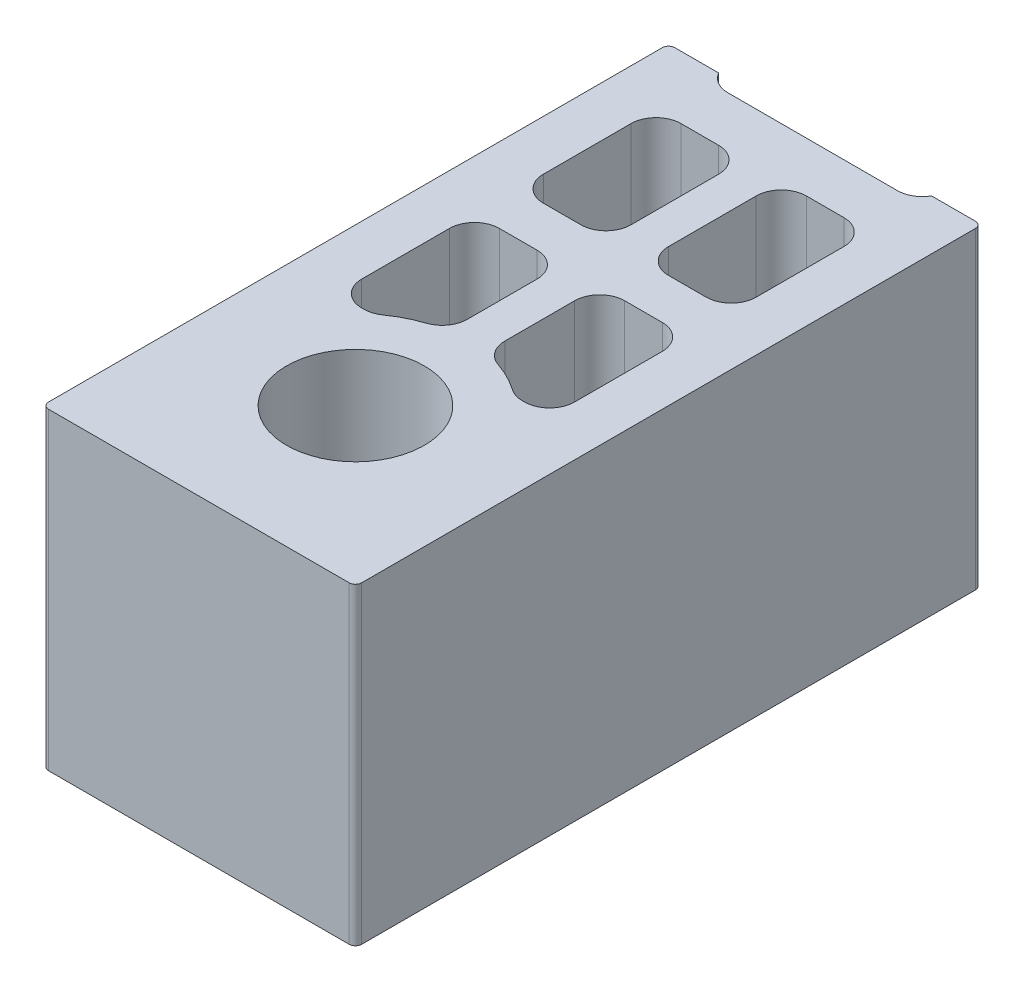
SolidWorks part; units mm, degrees
ref_plane "Plan de face" through (0, 0, 0) normal (0, 0, 1) x (1, 0, 0)
ref_plane "Plan de dessus" through (0, 0, 0) normal (0, 1, 0) x (1, 0, 0)
ref_plane "Plan de droite" through (0, 0, 0) normal (1, 0, 0) x (0, 0, -1)
sketch "Esquisse1" plane through (0, 0, 0) normal (0, 1, 0) x (1, 0, 0)
  line L0 (0, -20.2628) -> (0, 58.4186) construction
  line L1 (-24.3225, 0) -> (29.7425, 0) construction
  line L2 (25, -20.2628) -> (25, 58.4186) construction
  line L3 (-24.3225, 50) -> (34.6841, 50) construction
  line L4 (4, 55.6667) -> (4, -3.7395) construction
  line L5 (-3.5126, 49) -> (27.2256, 49) construction
  line L6 (-17.7609, 25) -> (23.5775, 25) construction
  line L7 (12.5, 55.6667) -> (12.5, -13.5587) construction
  line L8 (0.5, 0) -> (24.5, 0)
  line L9 (21, 55.6667) -> (21, -3.7395) construction
  line L10 (-3.5126, 1) -> (27.2256, 1) construction
  line L11 (4, 49) -> (21, 49)
  line L12 (4, 49) -> (4, 50)
  line L14 (21, 49) -> (21, 50)
  line L17 (21, 50) -> (24.5, 50)
  line L19 (0.5, 50) -> (4, 50)
  line L20 (0, 49.5) -> (0, 0.5)
  line L22 (25, 49.5) -> (25, 0.5)
  arc A0 (0.5, 50) -> (0, 49.5) centre (0.5, 49.5) ccw
  arc A1 (24.5, 50) -> (25, 49.5) centre (24.5, 49.5) cw
  arc A2 (24.5, 0) -> (25, 0.5) centre (24.5, 0.5) ccw
  arc A3 (0, 0.5) -> (0.5, 0) centre (0.5, 0.5) ccw
  dimension "D6" = 0.5
  dimension "D1" = 25
  dimension "D2" = 50
  dimension "D3" = 25
  dimension "D4" = 12.5
  dimension "D5" = 4
  dimension "D7" = 1
extrude "Extrusion1" add sketch "Esquisse1" along normal blind 25
sketch "Esquisse2" plane through (0, 0, 0) normal (0, -1, 0) x (1, 0, 0)
  line L0 (0, 9.4676) -> (0, -60.8727) construction
  line L1 (-5.7031, 0) -> (29.0572, 0) construction
  line L2 (29.0572, -25) -> (-5.7031, -25) construction
  line L3 (12.5, 9.4676) -> (12.5, -60.8727) construction
  line L4 (4, 9.4676) -> (4, -52.8814) construction
  line L5 (9.6643, -12.5) -> (19.7875, -12.5) construction
  line L6 (-5.7031, -5) -> (39.022, -5) construction
  line L7 (-5.7031, -16) -> (39.022, -16) construction
  line L8 (-5.7031, -19.5) -> (39.022, -19.5) construction
  line L9 (11, -52.8814) -> (11, 9.4676) construction
  line L10 (-5.7031, -45) -> (39.022, -45) construction
  line L11 (-5.7031, -34) -> (39.022, -34) construction
  line L12 (-5.7031, -30.5) -> (39.022, -30.5) construction
  line L13 (4, -45) -> (11, -45)
  line L14 (4, -45) -> (4, -34)
  line L15 (4, -34) -> (11, -34)
  line L16 (11, -45) -> (11, -34)
  line L17 (4, -30.5) -> (11, -30.5)
  line L18 (4, -30.5) -> (4, -19.5)
  line L19 (4, -19.5) -> (6.8431, -19.5)
  line L20 (11, -21.3741) -> (11, -30.5)
  line L21 (21, -19.5) -> (18.1569, -19.5)
  line L22 (14, -21.3741) -> (14, -30.5)
  line L23 (21, -30.5) -> (14, -30.5)
  line L24 (21, -30.5) -> (21, -19.5)
  line L32 (14, -45) -> (14, -34)
  line L33 (21, -34) -> (14, -34)
  line L34 (21, -45) -> (21, -34)
  line L35 (21, -45) -> (14, -45)
  circle A0 centre (12.5, -12.5) radius 5.5
  arc A1 (14, -21.3741) -> (18.1569, -19.5) centre (12.5, -12.5) ccw
  arc A3 (6.8431, -19.5) -> (11, -21.3741) centre (12.5, -12.5) ccw
  dimension "D1" = 25
  dimension "D2" = 12.5
  dimension "D3" = 1.5
  dimension "D4" = 5
  dimension "D5" = 11
  dimension "D6" = 3.5
  dimension "D7" = 4
  dimension "D8" = 12.5
extrude "Enlèv. mat.-Extru.1" cut sketch "Esquisse2" against normal blind 25
fillet "Congé1" radius 2 20 edges at (4, 12.5, -49) (21, 12.5, -49) (21, 12.5, -34) (11, 12.5, -34) (11, 12.5, -21.3741) (21, 12.5, -19.5) (21, 12.5, -30.5) (11, 12.5, -30.5) (11, 12.5, -45) (21, 12.5, -45) (14, 12.5, -30.5) (14, 12.5, -45) (4, 12.5, -45) (4, 12.5, -30.5) (18.1569, 12.5, -19.5) (6.8431, 12.5, -19.5) (14, 12.5, -21.3741) (14, 12.5, -34) (4, 12.5, -34) (4, 12.5, -19.5)
